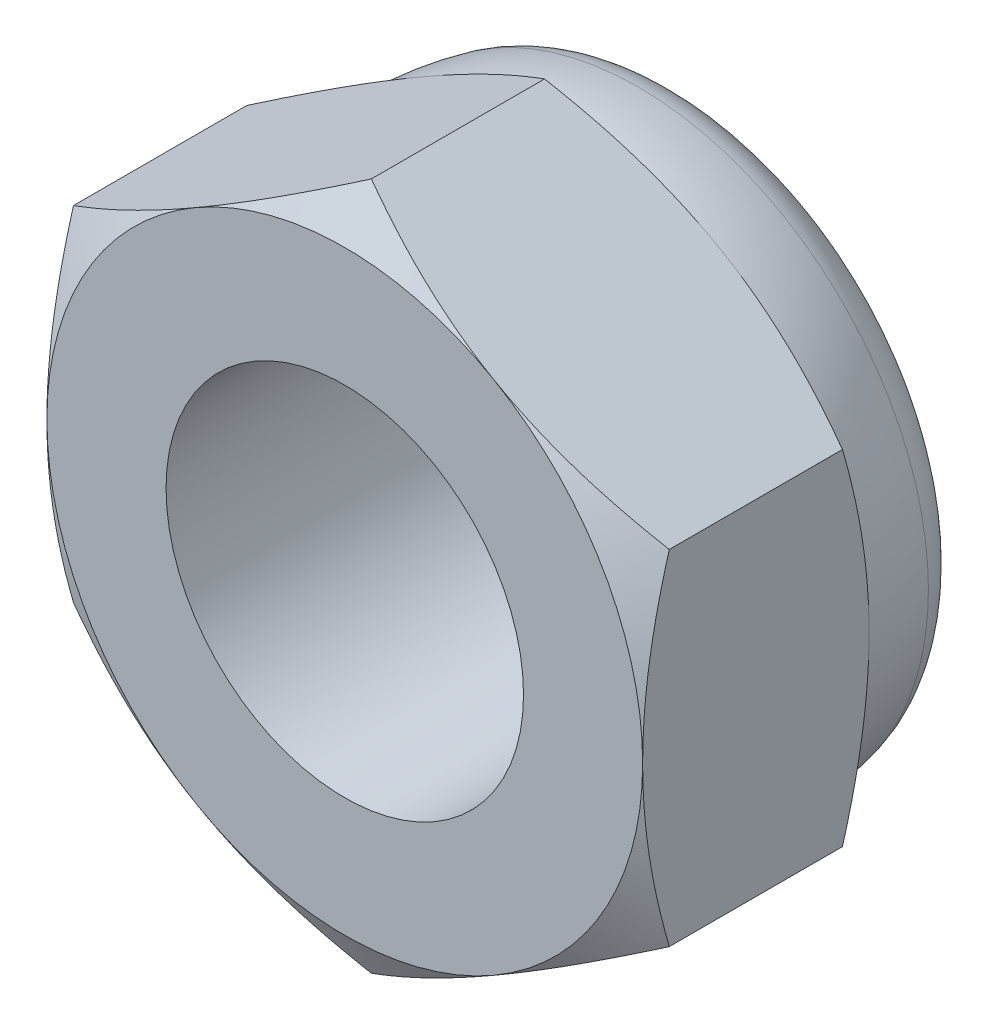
SolidWorks part; units mm, degrees
ref_plane "Plan1" through (0, 0, 0) normal (0, 0, 1) x (1, 0, 0)
ref_plane "Plan2" through (0, 0, 0) normal (0, 1, 0) x (1, 0, 0)
ref_plane "Plan3" through (0, 0, 0) normal (1, 0, 0) x (0, 0, -1)
sketch "Esquisse1" plane through (0, 0, 0) normal (0, 0, 1) x (1, 0, 0)
  line L0 (0, 0) -> (5, 0) construction
  line L1 (5, -2.8868) -> (5, 2.8868)
  line L2 (0, 0) -> (5, 2.8868) construction
  line L3 (0, 0) -> (0, 5.7735) construction
  line L4 (5, 2.8868) -> (0, 5.7735)
  line L5 (5, -2.8868) -> (0, -5.7735)
  line L6 (-5, -2.8868) -> (0, -5.7735)
  line L7 (-5, -2.8868) -> (-5, 2.8868)
  line L8 (-5, 2.8868) -> (0, 5.7735)
  circle A0 centre (0, 0) radius 5 construction
  circle A1 centre (0, 0) radius 5.7735 construction
  dimension "D2" = 10
  dimension "D1" = 30
extrude "Base-Extrusion" add sketch "Esquisse1" against normal blind 3.8
sketch "Esquisse2" plane through (0, 0, 0) normal (0, 1, 0) x (1, 0, 0)
  line L0 (-5, 0) -> (-9.2909, 0)
  line L1 (0, 3.8) -> (0, 0) construction
  line L2 (-5, 3.8) -> (-9.2909, 3.8)
  line L3 (-9.2909, 3.8) -> (-9.2909, 0)
  line L5 (-8.2909, 1.9) -> (-5, 3.8)
  line L6 (0, 3.8) -> (0, 0) construction
  line L7 (-5, 0) -> (-8.2909, 1.9)
  dimension "D1" = 30
  dimension "D2" = 1
  dimension "D3" = 30
revolve "Enlèvement de matière-Révolution1" cut sketch "Esquisse2" angle 360 about L6
sketch "Esquisse4" plane through (0, 0, 0) normal (0, 1, 0) x (1, 0, 0)
  line L0 (0, 0) -> (0, 8.8) construction
  line L2 (0, 8.8) -> (0, 3.8)
  line L3 (0, 3.8) -> (-5, 3.8)
  arc A0 (0, 8.8) -> (-5, 3.8) centre (0, 3.8) ccw
  dimension "D1" = 8.8
revolve "Boss.-Révol.1" add sketch "Esquisse4" angle 360 about L0
ref_plane "Plan4" through (0, 0, -5.7) normal (0, 0, 1) x (1, 0, 0)
sketch "Esquisse5" plane through (0, 0, -5.7) normal (0, 0, 1) x (1, 0, 0)
  arc A6 (5, 0) -> (2.5, 4.3301) centre (0, 0) ccw
  arc A7 (2.5, -4.3301) -> (5, 0) centre (0, 0) ccw
  arc A8 (-2.5, -4.3301) -> (2.5, -4.3301) centre (0, 0) ccw
  arc A9 (-5, 0) -> (-2.5, -4.3301) centre (0, 0) ccw
  arc A10 (-2.5, 4.3301) -> (-5, 0) centre (0, 0) ccw
  arc A11 (2.5, 4.3301) -> (-2.5, 4.3301) centre (0, 0) ccw
  arc A12 (5, 0) -> (2.5, 4.3301) centre (0, 0) ccw
  arc A13 (2.5, -4.3301) -> (5, 0) centre (0, 0) ccw
  arc A14 (-2.5, -4.3301) -> (2.5, -4.3301) centre (0, 0) ccw
  arc A15 (-5, 0) -> (-2.5, -4.3301) centre (0, 0) ccw
  arc A16 (-2.5, 4.3301) -> (-5, 0) centre (0, 0) ccw
  arc A17 (2.5, 4.3301) -> (-2.5, 4.3301) centre (0, 0) ccw
  dimension "D1" = 0
extrude "Enlèv. mat.-Extru.2" cut sketch "Esquisse5" against normal through all
fillet "Congé1" radius 1 1 edges at (4.6249, 0, -5.7)
sketch "Esquisse3" plane through (0, 0, 0) normal (0, 0, 1) x (1, 0, 0)
  circle A0 centre (0, 0) radius 3
  dimension "D1" = 6
extrude "Enlèv. mat.-Extru.1" cut sketch "Esquisse3" against normal through all
ref_axis "Axe1" through (0, 0, -37.5421) along (0, 0, 1)
sketch "Esquisse6" plane through (0, 0, 0) normal (0, 1, 0) x (1, 0, 0)
  line L0 (3, 0) -> (3, 5.7) construction
  line L1 (3, 5.8) -> (2.5, 5.8)
  line L2 (3, 5.8) -> (3, 4.3)
  line L3 (3, 4.3) -> (2.5, 4.3)
  line L4 (2.5, 5.8) -> (2.5, 4.3)
  line L7 (3, 5.7) -> (-3, 5.7) construction
  dimension "D1" = 1.5
  dimension "D2" = 0.5
  dimension "D3" = 0.1
revolve "Révolution2" add sketch "Esquisse6" angle 360 about axis through (0, 0, -37.5421) along (0, 0, 1)
